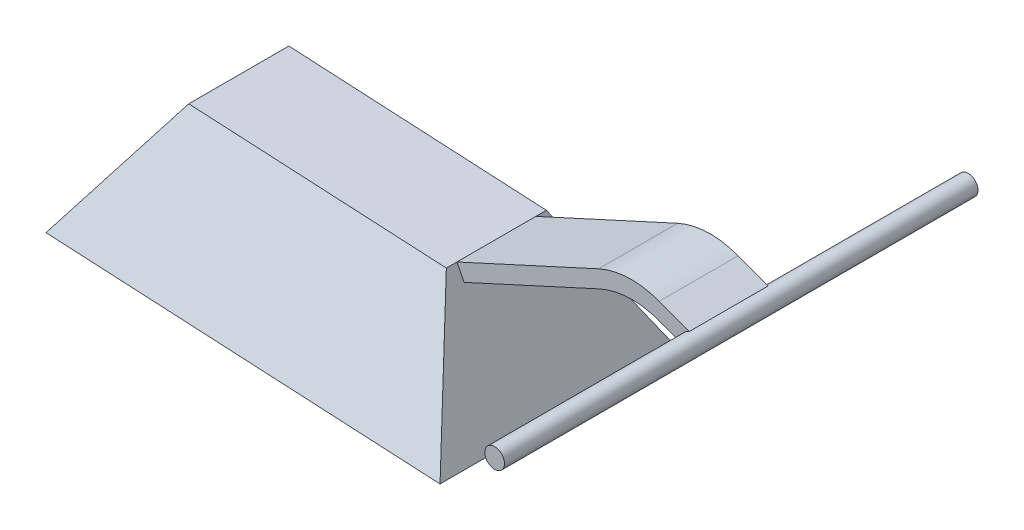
SolidWorks part; units mm, degrees
ref_plane "前视基准面" through (0, 0, 0) normal (0, 0, 1) x (1, 0, 0)
ref_plane "上视基准面" through (0, 0, 0) normal (0, 1, 0) x (1, 0, 0)
ref_plane "右视基准面" through (0, 0, 0) normal (1, 0, 0) x (0, 0, -1)
sketch "草图1" plane through (85.9411, -2.2504, 0) normal (-0.0523, -0.9986, 0) x (-0.9986, 0.0523, 0)
  line L0 (85.9411, 0) -> (89.6377, 0) construction
  line L1 (85.9411, 0) -> (85.9411, 60.0356) construction
  line L3 (60.9411, -15) -> (110.9411, -15)
  line L4 (60.9411, -15) -> (60.9411, 15)
  line L5 (60.9411, 15) -> (110.9411, 15)
  line L6 (110.9411, -15) -> (110.9411, 15)
  line L7 (60.9411, -15) -> (110.9411, 15) construction
  line L8 (60.9411, 15) -> (110.9411, -15) construction
  dimension "D1" = 50
  dimension "D2" = 30
extrude "凸台-拉伸1" add sketch "草图1" against normal blind 15 draft 30
sketch "草图2" plane through (0, 0, 0) normal (0, 0, 1) x (1, 0, 0)
  line L0 (47, 20) -> (47, 25.6367) construction
  line L1 (45.5, 20) -> (48.5, 20) construction
  circle A0 centre (47, 22.25) radius 1.25
  point P6 (0, 0)
  dimension "D1" = 2.5
  dimension "D2" = 1
extrude "凸台-拉伸2" add sketch "草图2" along normal mid plane 60 separate body
sketch "草图3" plane through (0, 0, 0) normal (0, 0, 1) x (1, 0, 0)
  line L0 (16.1099, 14.763) -> (39, 25.25)
  line L1 (39, 25.25) -> (47, 22.25)
  point P2 (19.9678, 12.882)
  point P3 (20.9087, 12.0218)
  point P6 (12.7378, 12.3915)
  point P7 (16.2792, 14.4011)
  dimension "D1" = 3
  dimension "D2" = 8
  dimension "D3" = 1
extrude "拉伸-薄壁1" add sketch "草图3" along normal mid plane 10 thin
fillet "圆角1" radius 10 2 edges at (39.0384, 24.1676, 0) (38.9616, 26.3324, 0)
